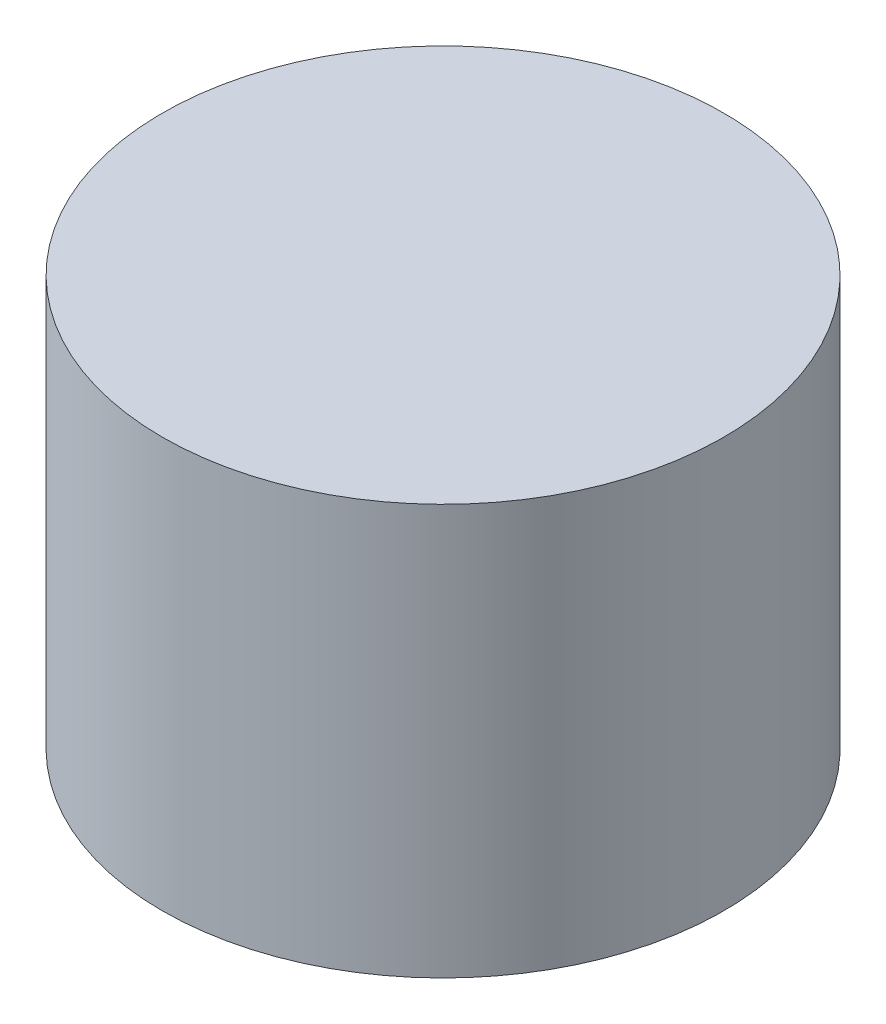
SolidWorks part; units mm, degrees
ref_plane "Front Plane" through (0, 0, 0) normal (0, 0, 1) x (1, 0, 0)
ref_plane "Top Plane" through (0, 0, 0) normal (0, 1, 0) x (1, 0, 0)
ref_plane "Right Plane" through (0, 0, 0) normal (1, 0, 0) x (0, 0, -1)
sketch "Sketch2" plane through (0, 0, 0) normal (0, 1, 0) x (1, 0, 0)
  circle A0 centre (0, 0) radius 15
  point P2 (0, 0)
  dimension "D1" = 30
extrude "Boss-Extrude1" add sketch "Sketch2" along normal mid plane 21.92 contours A0
